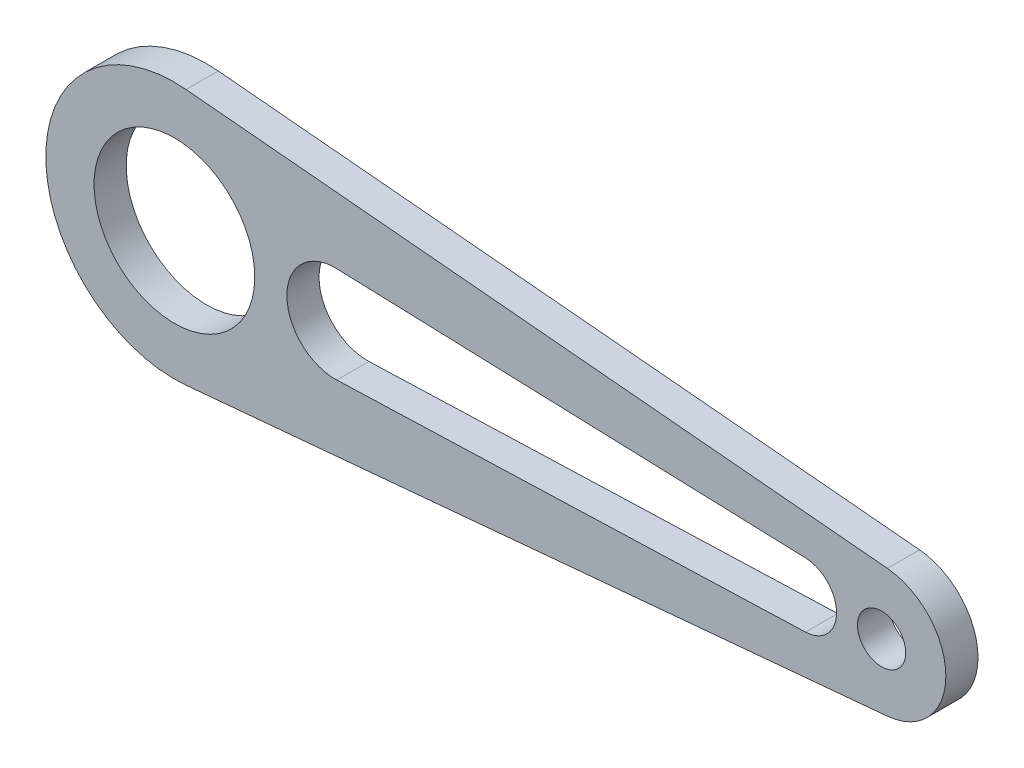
SolidWorks part; units mm, degrees
ref_plane "Front Plane" through (0, 0, 0) normal (0, 0, 1) x (1, 0, 0)
ref_plane "Top Plane" through (0, 0, 0) normal (0, 1, 0) x (1, 0, 0)
ref_plane "Right Plane" through (0, 0, 0) normal (1, 0, 0) x (0, 0, -1)
sketch "Sketch1" plane through (0, 0, 0) normal (0, 0, 1) x (1, 0, 0)
  line L0 (1.1545, 12.6474) -> (70.4273, 6.3237)
  line L1 (70.4273, -6.3237) -> (1.1545, -12.6474)
  line L2 (62.3387, 3.1731) -> (16.0381, 4.7597)
  line L3 (62.3387, -3.1731) -> (16.0381, -4.7597)
  line L4 (69.85, 0) -> (29.8715, 0) construction
  circle A0 centre (0, 0) radius 7.9375
  arc A1 (1.1545, 12.6474) -> (1.1545, -12.6474) centre (0, 0) ccw
  arc A2 (70.4273, -6.3237) -> (70.4273, 6.3237) centre (69.85, 0) ccw
  circle A3 centre (69.85, 0) radius 2.3813
  arc A4 (62.3387, -3.1731) -> (62.3387, 3.1731) centre (62.23, 0) ccw
  arc A5 (16.0381, 4.7597) -> (16.0381, -4.7597) centre (15.875, 0) ccw
  dimension "D1" = 4.7625
  dimension "D2" = 15.875
  dimension "D4" = 25.4
  dimension "D5" = 12.7
  dimension "D6" = 6.35
  dimension "D7" = 9.525
  dimension "D9" = 15.875
  dimension "D3" = 69.85
  dimension "D8" = 7.62
extrude "Extrude1" add sketch "Sketch1" along normal mid plane 3.175
